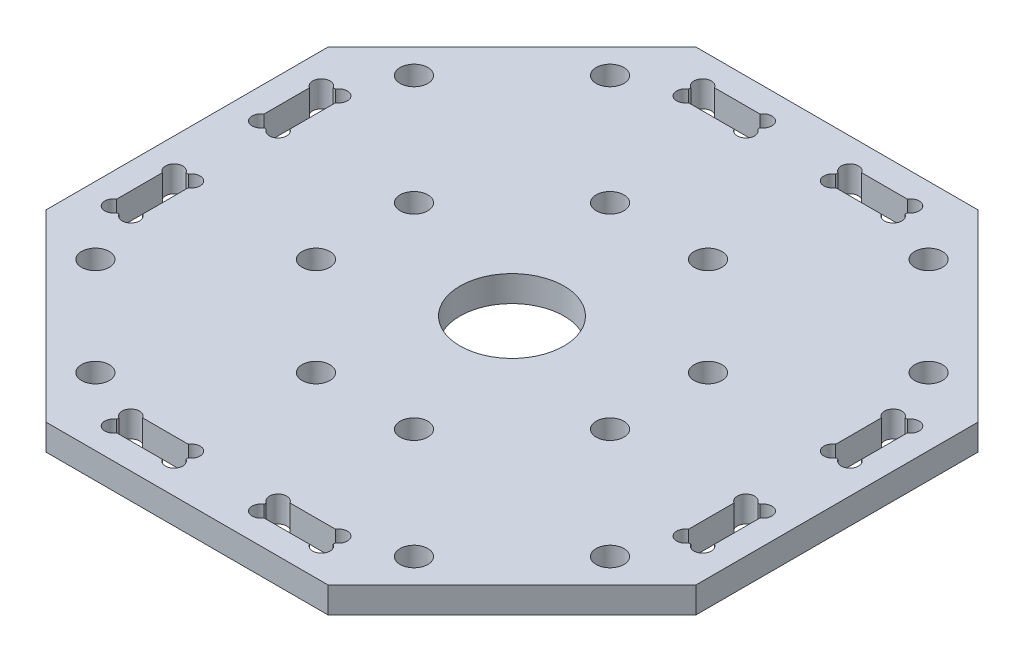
SolidWorks part; units mm, degrees
ref_plane "前视基准面" through (0, 0, 0) normal (0, 0, 1) x (1, 0, 0)
ref_plane "上视基准面" through (0, 0, 0) normal (0, 1, 0) x (1, 0, 0)
ref_plane "右视基准面" through (0, 0, 0) normal (1, 0, 0) x (0, 0, -1)
sketch "草图1" plane through (0, 0, 0) normal (0, 1, 0) x (1, 0, 0)
  line L1 (-37.5, -37.5) -> (37.5, -37.5)
  line L2 (-37.5, -37.5) -> (-37.5, 37.5)
  line L3 (-37.5, 37.5) -> (37.5, 37.5)
  line L4 (37.5, -37.5) -> (37.5, 37.5)
  line L5 (-37.5, -37.5) -> (37.5, 37.5) construction
  line L6 (-37.5, 37.5) -> (37.5, -37.5) construction
  circle A0 centre (0, 0) radius 6
  point P0 (0, 0)
  dimension "D3" = 12
  dimension "D1" = 75
  dimension "D2" = 75
extrude "凸台-拉伸1" add sketch "草图1" along normal blind 3
hole_wizard "Ø3.2 (3.2) 直径孔1" positions "草图2" profile "草图3" hole size "Ø3.2" standard "GB"
sketch "草图2" plane through (0, 3, 0) normal (0, 1, 0) x (1, 0, 0)
  line L0 (-37.5, 37.5) -> (37.5, -37.5) construction
  line L4 (37.5, 37.5) -> (-37.5, -37.5) construction
  line L5 (0, 37.5) -> (0, -37.5) construction
  line L6 (37.5, 37.5) -> (-37.5, 37.5) construction
  line L7 (-37.5, -37.5) -> (37.5, -37.5) construction
  point P14 (16.9706, -5.6569)
  point P25 (5.6569, -16.9706)
  point P26 (29.6985, -18.3848)
  point P30 (18.3848, -29.6985)
  point P32 (-29.6985, 18.3848)
  point P33 (-18.3848, 29.6985)
  point P34 (-5.6569, 16.9706)
  point P35 (-16.9706, 5.6569)
  point P45 (-5.6569, -16.9706)
  point P46 (-18.3848, -29.6985)
  point P47 (-29.6985, -18.3848)
  point P48 (-16.9706, -5.6569)
  point P49 (5.6569, 16.9706)
  point P50 (16.9706, 5.6569)
  point P51 (29.6985, 18.3848)
  point P52 (18.3848, 29.6985)
  dimension "D1" = 32
  dimension "D2" = 16
  dimension "D3" = 16
  dimension "D4" = 18
sketch "草图3" plane through (18.3848, 3, -29.6985) normal (1, 0, 0) x (0, 0, 1)
  line L0 (0, 0) -> (0, 3)
  line L1 (0, 3) -> (1.6, 3)
  line L2 (1.6, 3) -> (1.6, 0)
  line L5 (1.6, 0) -> (0, 0)
  line L11 (0, -6.35) -> (0, 107.95) construction
  dimension "通孔孔直径" = 3.2
  dimension "通孔孔深度" = 3
sketch "草图4" plane through (0, 3, 0) normal (0, 1, 0) x (1, 0, 0)
  line L0 (-37.5, 0) -> (37.5, 0) construction
  line L1 (-37.5, 37.5) -> (-37.5, -37.5) construction
  line L2 (37.5, -37.5) -> (37.5, 37.5) construction
  line L3 (0, 37.5) -> (0, -37.5) construction
  line L4 (37.5, 37.5) -> (-37.5, 37.5) construction
  line L5 (-37.5, -37.5) -> (37.5, -37.5) construction
  line L6 (-37.5, 37.5) -> (37.5, -37.5) construction
  line L7 (-31.5, -12.5) -> (-31.5, -4.5)
  line L8 (-34.5, 12.5) -> (-31.5, 12.5)
  line L9 (-34.5, 12.5) -> (-34.5, 4.5)
  line L10 (-34.5, 4.5) -> (-31.5, 4.5)
  line L11 (-31.5, 12.5) -> (-31.5, 4.5)
  line L12 (-34.5, -4.5) -> (-31.5, -4.5)
  line L13 (-34.5, -12.5) -> (-34.5, -4.5)
  line L14 (37.5, 37.5) -> (-37.5, -37.5) construction
  line L15 (-34.5, -12.5) -> (-31.5, -12.5)
  line L16 (12.5, 34.5) -> (12.5, 31.5)
  line L17 (12.5, 34.5) -> (4.5, 34.5)
  line L18 (4.5, 34.5) -> (4.5, 31.5)
  line L19 (-12.5, 31.5) -> (-4.5, 31.5)
  line L20 (-4.5, 34.5) -> (-4.5, 31.5)
  line L21 (-12.5, 34.5) -> (-4.5, 34.5)
  line L22 (-12.5, 34.5) -> (-12.5, 31.5)
  line L23 (12.5, 31.5) -> (4.5, 31.5)
  line L24 (31.5, 12.5) -> (31.5, 4.5)
  line L25 (34.5, -12.5) -> (31.5, -12.5)
  line L26 (34.5, -12.5) -> (34.5, -4.5)
  line L27 (34.5, -4.5) -> (31.5, -4.5)
  line L28 (31.5, -12.5) -> (31.5, -4.5)
  line L29 (34.5, 4.5) -> (31.5, 4.5)
  line L30 (34.5, 12.5) -> (34.5, 4.5)
  line L31 (34.5, 12.5) -> (31.5, 12.5)
  line L32 (-12.5, -34.5) -> (-12.5, -31.5)
  line L33 (-12.5, -34.5) -> (-4.5, -34.5)
  line L34 (-4.5, -34.5) -> (-4.5, -31.5)
  line L35 (12.5, -31.5) -> (4.5, -31.5)
  line L36 (4.5, -34.5) -> (4.5, -31.5)
  line L37 (12.5, -34.5) -> (4.5, -34.5)
  line L38 (12.5, -34.5) -> (12.5, -31.5)
  line L39 (-12.5, -31.5) -> (-4.5, -31.5)
  dimension "D1" = 3
  dimension "D2" = 3
  dimension "D3" = 8
  dimension "D4" = 25
extrude "切除-拉伸1" cut sketch "草图4" against normal blind 10
sketch "草图5" plane through (0, 3, 0) normal (0, 1, 0) x (1, 0, 0)
  line L0 (-37.5, 0) -> (37.5, 0) construction
  line L1 (-37.5, 37.5) -> (-37.5, -37.5) construction
  line L2 (37.5, -37.5) -> (37.5, 37.5) construction
  line L3 (0, 37.5) -> (0, -37.5) construction
  line L4 (37.5, 37.5) -> (-37.5, 37.5) construction
  line L5 (-37.5, -37.5) -> (37.5, -37.5) construction
  line L6 (-37.5, 37.5) -> (37.5, -37.5) construction
  line L7 (37.5, 37.5) -> (-37.5, -37.5) construction
  line L8 (-16.2868, 37.5) -> (-37.5, 16.2868)
  line L9 (-37.5, 16.2868) -> (-37.5, 37.5)
  line L10 (-37.5, 37.5) -> (-16.2868, 37.5)
  line L11 (37.5, 37.5) -> (16.2868, 37.5)
  line L12 (37.5, 16.2868) -> (37.5, 37.5)
  line L13 (16.2868, 37.5) -> (37.5, 16.2868)
  line L14 (16.2868, -37.5) -> (37.5, -16.2868)
  line L15 (37.5, -16.2868) -> (37.5, -37.5)
  line L16 (37.5, -37.5) -> (16.2868, -37.5)
  line L17 (-37.5, -37.5) -> (-16.2868, -37.5)
  line L18 (-37.5, -16.2868) -> (-37.5, -37.5)
  line L19 (-16.2868, -37.5) -> (-37.5, -16.2868)
  dimension "D1" = 30
  dimension "D2" = 45
extrude "切除-拉伸2" cut sketch "草图5" against normal blind 10
hole_wizard "Ø2.0 (2) 直径孔1" positions "草图6" profile "草图7" hole size "Ø2.0" standard "GB"
sketch "草图6" plane through (0, 3, 0) normal (0, 1, 0) x (1, 0, 0)
  line L0 (-12.5, 31.5) -> (-4.5, 31.5) construction
  line L1 (-12.5, 34.5) -> (-12.5, 31.5) construction
  line L2 (-12.5, 33) -> (-4.5, 33) construction
  line L3 (-4.5, 31.5) -> (-4.5, 34.5) construction
  line L5 (-8.5, 34.5) -> (-8.5, 31.5) construction
  line L6 (-4.5, 34.5) -> (-12.5, 34.5) construction
  line L8 (0, 37.5) -> (0, -37.5) construction
  line L9 (16.2868, 37.5) -> (-16.2868, 37.5) construction
  line L10 (-16.2868, -37.5) -> (16.2868, -37.5) construction
  line L12 (-26.8934, 26.8934) -> (26.8934, -26.8934) construction
  line L13 (-37.5, 16.2868) -> (-16.2868, 37.5) construction
  line L14 (37.5, -16.2868) -> (16.2868, -37.5) construction
  point P0 (-12, 32)
  point P21 (-12, 34)
  point P22 (-5, 34)
  point P23 (-5, 32)
  point P39 (5, 32)
  point P40 (5, 34)
  point P41 (12, 34)
  point P42 (12, 32)
  point P43 (-32, 5)
  point P44 (-34, 5)
  point P45 (-34, 12)
  point P46 (-32, 12)
  point P47 (-32, -12)
  point P48 (-34, -12)
  point P49 (-34, -5)
  point P50 (-32, -5)
  point P51 (32, -5)
  point P52 (34, -5)
  point P53 (34, -12)
  point P54 (32, -12)
  point P55 (32, 12)
  point P56 (34, 12)
  point P57 (34, 5)
  point P58 (32, 5)
  point P60 (-5, -32)
  point P61 (-5, -34)
  point P62 (-12, -34)
  point P63 (-12, -32)
  point P64 (12, -32)
  point P65 (12, -34)
  point P66 (5, -34)
  point P67 (5, -32)
  dimension "D1" = 0.5
  dimension "D2" = 0.5
sketch "草图7" plane through (-12, 3, -32) normal (1, 0, 0) x (0, 0, 1)
  line L0 (0, 0) -> (0, 3)
  line L1 (0, 3) -> (1, 3)
  line L2 (1, 3) -> (1, 0)
  line L5 (1, 0) -> (0, 0)
  line L11 (0, -6.35) -> (0, 107.95) construction
  dimension "通孔孔直径" = 2
  dimension "通孔孔深度" = 3
